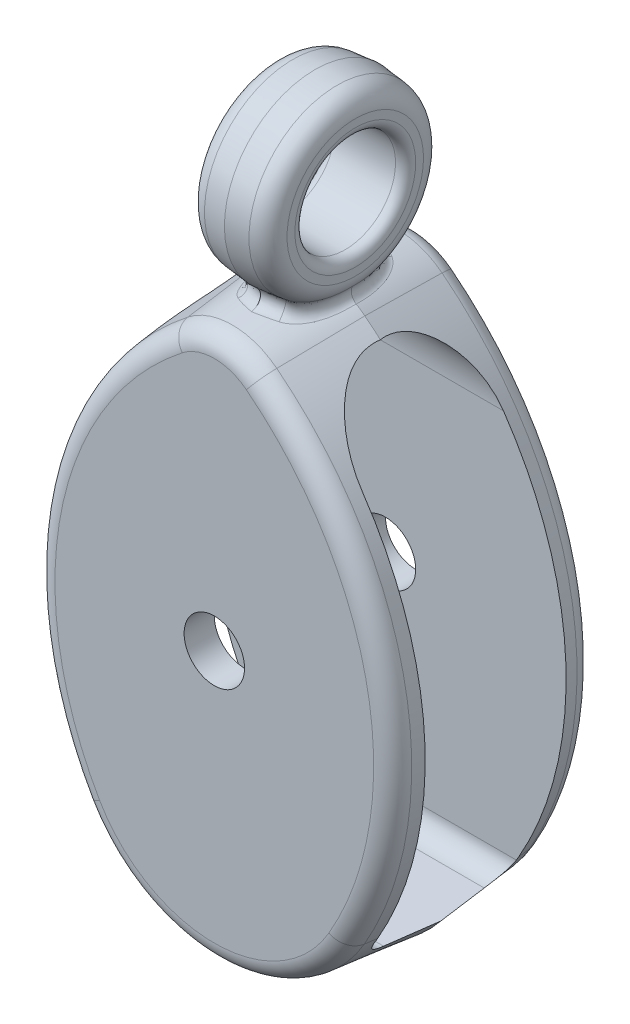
SolidWorks part; units mm, degrees
ref_plane "Front" through (0, 0, 0) normal (0, 0, 1) x (1, 0, 0)
ref_plane "Top" through (0, 0, 0) normal (0, 1, 0) x (1, 0, 0)
ref_plane "Right" through (0, 0, 0) normal (1, 0, 0) x (0, 0, -1)
sketch "Base" plane through (0, 0, 0) normal (0, 0, 1) x (1, 0, 0)
  line L0 (0, 0) -> (0, 16) construction
  arc A0 (-2.4744, 19.1429) -> (2.4744, 19.1429) centre (0, 16) cw
  arc A1 (-6.9282, -4) -> (6.9282, -4) centre (0, 0) ccw
  arc A2 (6.9282, -4) -> (2.4744, 19.1429) centre (-8.6603, 5) ccw
  arc A3 (-6.9282, -4) -> (-2.4744, 19.1429) centre (8.6603, 5) cw
  dimension "D2" = 4
  dimension "D3" = 8
  dimension "D4" = 18
  dimension "D1" = 16
sketch "Hanger" plane through (0, 0, 0) normal (1, 0, 0) x (0, 0, -1)
  line L1 (0, 0) -> (0, 16) construction
  circle A0 centre (0, 24) radius 4.5
  dimension "D2" = 9
  dimension "D1" = 24
sketch "Center Cut" plane through (0, 0, 0) normal (1, 0, 0) x (0, 0, -1)
  line L0 (-3.5, -5) -> (-3.5, 15)
  line L1 (-3.5, -5) -> (3.5, -5)
  line L2 (3.5, -5) -> (3.5, 15)
  arc A0 (3.5, 15) -> (-3.5, 15) centre (0, 15) ccw
  circle A2 centre (0, 24) radius 4.5 construction
  dimension "D1" = 9
  dimension "D2" = 20
  dimension "D3" = 7
extrude "Extrude1" add sketch "Base" along normal mid plane 10 draft 6
extrude "Extrude2" add sketch "Hanger" along normal mid plane 4 draft 6
extrude "Cut-Extrude1" cut sketch "Center Cut" against normal through all and the other way through all
fillet "Fillet1" radius 1 2 edges at (0, -5, 3.5) (0, -5, -3.5)
hole_wizard "M5.0 (5) Diameter Hole1" positions "Sketch2" profile "Sketch1" hole size "M5.0" standard "Ansi Metric"
sketch "Sketch2" plane through (2, 0, 0) normal (1, 0, 0) x (0, 0, -1)
  point P0 (0, 24)
sketch "Sketch1" plane through (2, 24, 0) normal (0, 1, 0) x (0, 0, -1)
  line L0 (0, 0) -> (0, 10.9719)
  line L1 (0, 10.9719) -> (2.5, 10.9719)
  line L2 (2.5, 10.9719) -> (2.5, 0)
  line L5 (2.5, 0) -> (0, 0)
  line L11 (0, -6.35) -> (0, 107.95) construction
  dimension "Thru Hole Dia." = 5
  dimension "Thru Hole Depth" = 10.9719
hole_wizard "M3.0 (3) Diameter Hole1" positions "Sketch4" profile "Sketch3" hole size "M3.0" standard "Ansi Metric"
sketch "Sketch4" plane through (0, 0, 5) normal (0, 0, 1) x (1, 0, 0)
  point P0 (0, 6)
  dimension "D1" = 6
sketch "Sketch3" plane through (0, 6, 5) normal (1, 0, 0) x (0, -1, 0)
  line L0 (0, 0) -> (0, 10)
  line L1 (0, 10) -> (1.5, 10)
  line L2 (1.5, 10) -> (1.5, 0)
  line L5 (1.5, 0) -> (0, 0)
  line L11 (0, -6.35) -> (0, 107.95) construction
  dimension "Thru Hole Dia." = 3
  dimension "Thru Hole Depth" = 10
fillet "Fillet2" radius 1 10 edges at (8.4993, 8.3024, 5) (0, 19.4745, 5) (-8.4993, 8.3024, -5) (0, 19.4745, -5) (8.4993, 8.3024, -5) (0, -7.4745, -5) (-2, 24, -4.2898) (2, 24, -4.2898) (-8.4993, 8.3024, 5) (0, -7.4745, 5)
fillet "Fillet3" radius 0.5 10 edges at (-1.3141, 19.7075, 0.6322) (-1.2992, 19.7085, -0.6707) (1.3141, 19.7075, -0.6322) (1.2992, 19.7085, 0.6707) (-0.5507, 19.8064, -1.4649) (0.5507, 19.8064, -1.4649) (0.5507, 19.8064, 1.4649) (-0.5507, 19.8064, 1.4649) (-2, 24, -2.5) (2, 24, -2.5)
